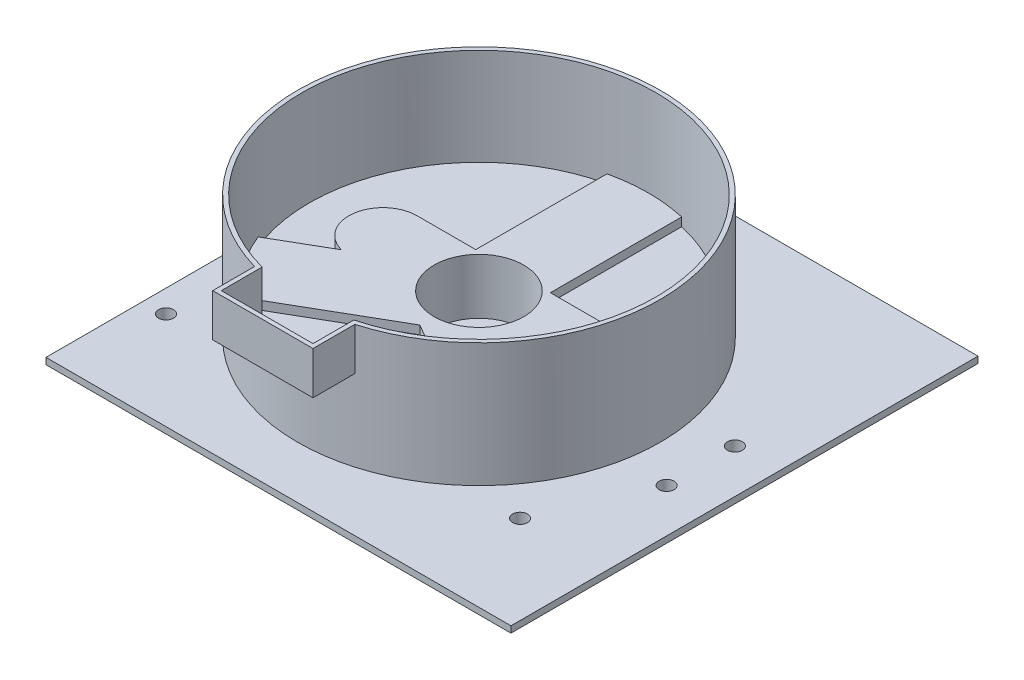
SolidWorks part; units mm, degrees
ref_plane "Front Plane" through (0, 0, 0) normal (0, 0, 1) x (1, 0, 0)
ref_plane "Top Plane" through (0, 0, 0) normal (0, 1, 0) x (1, 0, 0)
ref_plane "Right Plane" through (0, 0, 0) normal (1, 0, 0) x (0, 0, -1)
body saved out of another part "Stock-Plate-1"
